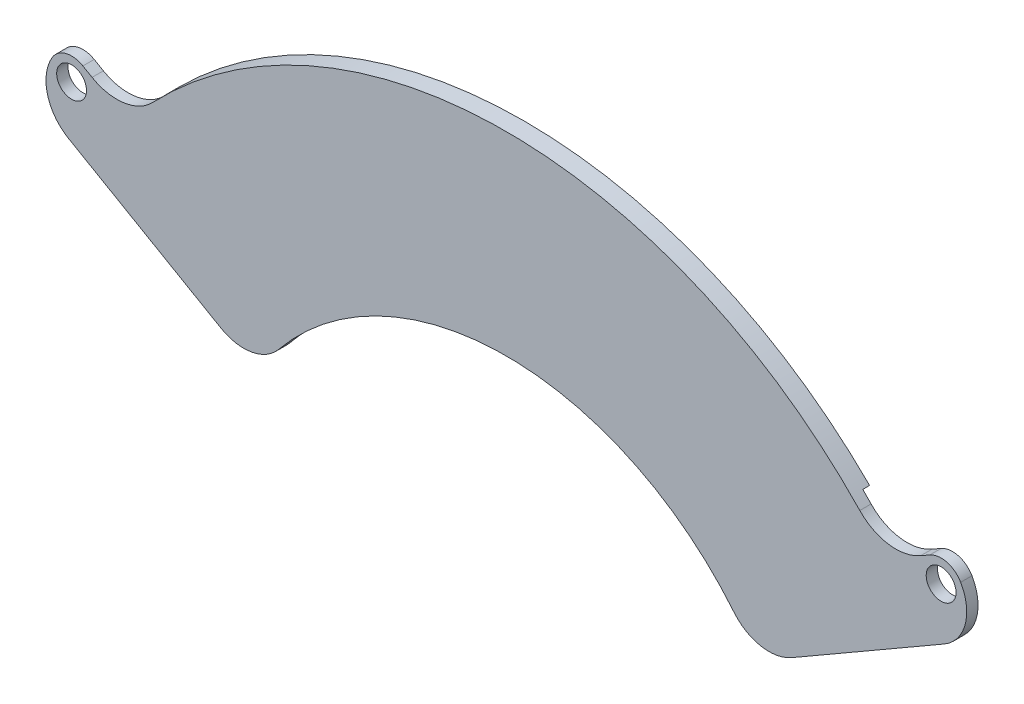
SolidWorks part; units mm, degrees
ref_plane "Face" through (0, 0, 0) normal (0, 0, 1) x (1, 0, 0)
ref_plane "Dessus" through (0, 0, 0) normal (0, 1, 0) x (1, 0, 0)
ref_plane "Droite" through (0, 0, 0) normal (1, 0, 0) x (0, 0, -1)
inserted part "etrier gauche"
other "<etrier gauche>-<Congé19>"
sketch "Esquisse1" plane through (0, 0, 1) normal (0, 0, -1) x (-1, 0, 0)
  line L0 (-105.5211, 63.2321) -> (-55.265, 34.2167)
  line L1 (55.265, 34.2167) -> (105.5211, 63.2321)
  line L2 (105.5211, 63.2321) -> (100.5211, 71.8923)
  line L3 (93.691, 73.7224) -> (91.6636, 72.5519)
  line L4 (-91.6636, 72.5519) -> (-93.691, 73.7224)
  line L5 (-100.5211, 71.8923) -> (-105.5211, 63.2321)
  line L6 (-108.2532, 62.5) -> (-54.5596, 31.5)
  line L7 (54.5596, 31.5) -> (108.2532, 62.5)
  line L8 (108.2532, 62.5) -> (102.2532, 72.8923)
  line L9 (92.691, 75.4545) -> (90.6636, 74.284)
  line L10 (-90.6636, 74.284) -> (-92.691, 75.4545)
  line L11 (-102.2532, 72.8923) -> (-108.2532, 62.5)
  line L12 (-108.2532, 62.5) -> (-54.5596, 31.5) construction
  line L13 (54.5596, 31.5) -> (108.2532, 62.5) construction
  line L14 (108.2532, 62.5) -> (102.2532, 72.8923) construction
  line L15 (92.691, 75.4545) -> (90.6636, 74.284) construction
  line L16 (-90.6636, 74.284) -> (-92.691, 75.4545) construction
  line L17 (-102.2532, 72.8923) -> (-108.2532, 62.5) construction
  arc A0 (55.265, 34.2167) -> (-55.265, 34.2167) centre (0, 0) ccw
  arc A1 (100.5211, 71.8923) -> (93.691, 73.7224) centre (96.191, 69.3923) ccw
  arc A2 (78.1989, 74.4911) -> (91.6636, 72.5519) centre (86.1636, 82.0782) ccw
  arc A3 (78.1989, 74.4911) -> (-78.1989, 74.4911) centre (0, 0) ccw
  arc A4 (-91.6636, 72.5519) -> (-78.1989, 74.4911) centre (-86.1636, 82.0782) ccw
  arc A5 (-93.691, 73.7224) -> (-100.5211, 71.8923) centre (-96.191, 69.3923) ccw
  arc A6 (54.5596, 31.5) -> (-54.5596, 31.5) centre (0, 0) ccw
  arc A7 (102.2532, 72.8923) -> (92.691, 75.4545) centre (96.191, 69.3923) ccw
  arc A8 (79.647, 75.8706) -> (90.6636, 74.284) centre (86.1636, 82.0782) ccw
  arc A9 (79.647, 75.8706) -> (-79.647, 75.8706) centre (0, 0) ccw
  arc A10 (-90.6636, 74.284) -> (-79.647, 75.8706) centre (-86.1636, 82.0782) ccw
  arc A11 (-92.691, 75.4545) -> (-102.2532, 72.8923) centre (-96.191, 69.3923) ccw
  arc A12 (54.5596, 31.5) -> (-54.5596, 31.5) centre (0, 0) ccw construction
  arc A13 (102.2532, 72.8923) -> (92.691, 75.4545) centre (96.191, 69.3923) ccw construction
  arc A14 (79.647, 75.8706) -> (90.6636, 74.284) centre (86.1636, 82.0782) ccw construction
  arc A15 (79.647, 75.8706) -> (-79.647, 75.8706) centre (0, 0) ccw construction
  arc A16 (-90.6636, 74.284) -> (-79.647, 75.8706) centre (-86.1636, 82.0782) ccw construction
  arc A17 (-92.691, 75.4545) -> (-102.2532, 72.8923) centre (-96.191, 69.3923) ccw construction
  dimension "D1" = 0
  dimension "D2" = 2
extrude "Extrusion1" add sketch "Esquisse1" along normal blind 4 separate body
hole_wizard "Dégagement M61" positions "Esquisse6" profile "Esquisse5" hole size "M6" standard "ISO"
sketch "Esquisse6" plane through (0, 0, -3) normal (0, 0, -1) x (-1, 0, 0)
  circle A0 centre (-96.191, 69.3923) radius 2.5 construction
  circle A2 centre (96.191, 69.3923) radius 2.5 construction
  point P0 (96.191, 69.3923)
  point P1 (-96.191, 69.3923)
sketch "Esquisse5" plane through (-96.191, 69.3923, -3) normal (1, 0, 0) x (0, 1, 0)
  line L0 (0, 0) -> (0, 39)
  line L1 (0, 39) -> (3.3, 39)
  line L2 (3.3, 39) -> (3.3, 0)
  line L5 (3.3, 0) -> (0, 0)
  line L11 (0, -6.35) -> (0, 107.95) construction
  dimension "Diamètre du perçage jusqu'au prochain" = 6.6
  dimension "Profondeur du perçage jusqu'au prochain" = 39
sketch "Esquisse7" plane through (0, 0, -3) normal (0, 0, -1) x (-1, 0, 0)
  line L0 (45.9619, 45.9619) -> (76.3675, 76.3675)
  line L1 (0, 0) -> (0, 159.1384) construction
  line L2 (-45.9619, 45.9619) -> (-76.3675, 76.3675)
  arc A0 (55.265, 34.2167) -> (-55.265, 34.2167) centre (0, 0) ccw construction
  arc A1 (78.1989, 74.4911) -> (-78.1989, 74.4911) centre (0, 0) ccw construction
  arc A2 (45.9619, 45.9619) -> (-45.9619, 45.9619) centre (0, 0) ccw
  arc A3 (76.3675, 76.3675) -> (-76.3675, 76.3675) centre (0, 0) ccw
  dimension "D1" = 90
extrude "Enlèv. mat.-Extru.2" cut sketch "Esquisse7" against normal blind 1.5 flip side to cut
delete or keep bodies "Corps-Effacer/suppr1" type delete bodies bodies 103
sketch "Esquisse8" plane through (0, 0, -3) normal (0, 0, -1) x (-1, 0, 0)
  line L2 (45.9619, 45.9619) -> (76.3675, 76.3675)
  line L3 (-76.3675, 76.3675) -> (-45.9619, 45.9619)
  line L4 (45.9619, 45.9619) -> (76.3675, 76.3675)
  line L5 (-76.3675, 76.3675) -> (-45.9619, 45.9619)
  arc A2 (45.9619, 45.9619) -> (-45.9619, 45.9619) centre (0, 0) ccw
  arc A3 (76.3675, 76.3675) -> (-76.3675, 76.3675) centre (0, 0) ccw
  arc A4 (45.9619, 45.9619) -> (-45.9619, 45.9619) centre (0, 0) ccw
  arc A5 (76.3675, 76.3675) -> (-76.3675, 76.3675) centre (0, 0) ccw
  dimension "D1" = 0
extrude "Extrusion2" add sketch "Esquisse8" along normal blind 4 separate body
delete or keep bodies "Corps-Effacer/suppr2" type delete bodies bodies 106
fillet "Congé1" radius 10 8 edges at (-103.0211, 67.5622, 1) (103.0211, 67.5622, 1) (-105.5211, 63.2321, -0.25) (-55.265, 34.2167, -0.25) (55.265, 34.2167, -0.25) (105.5211, 63.2321, -0.25) (-103.0211, 67.5622, -1.5) (103.0211, 67.5622, -1.5)
